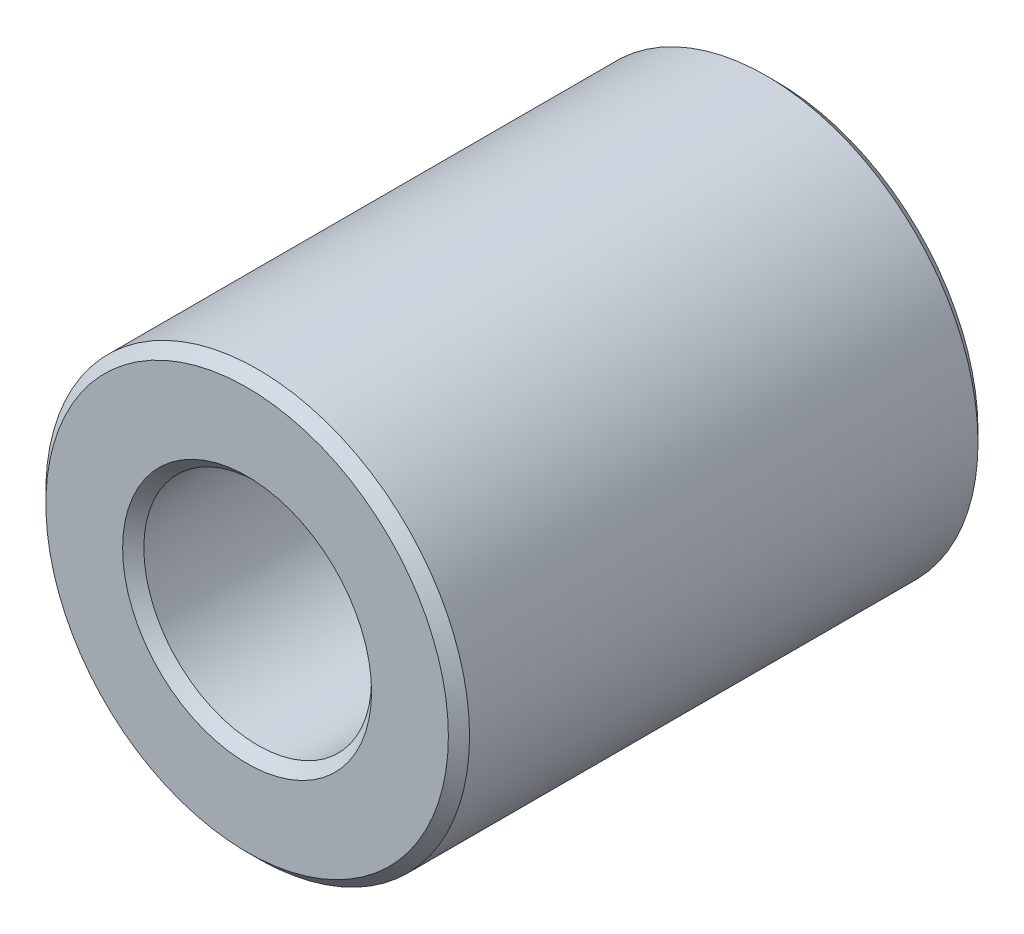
SolidWorks part; units mm, degrees
ref_plane "Front Plane" through (0, 0, 0) normal (0, 0, 1) x (1, 0, 0)
ref_plane "Top Plane" through (0, 0, 0) normal (0, 1, 0) x (1, 0, 0)
ref_plane "Right Plane" through (0, 0, 0) normal (1, 0, 0) x (0, 0, -1)
sketch "Sketch1" plane through (0, 0, 0) normal (0, 0, 1) x (1, 0, 0)
  circle A0 centre (0, 0) radius 4
  circle A1 centre (0, 0) radius 2.15
  dimension "D1" = 8
  dimension "D2" = 4.3
extrude "Boss-Extrude2" add sketch "Sketch1" along normal mid plane 10
chamfer "Chamfer3" distance 0.2 angle 45 4 edges at (4, 0, 5) (4, 0, -5) (2.15, 0, -5) (2.15, 0, 5)
